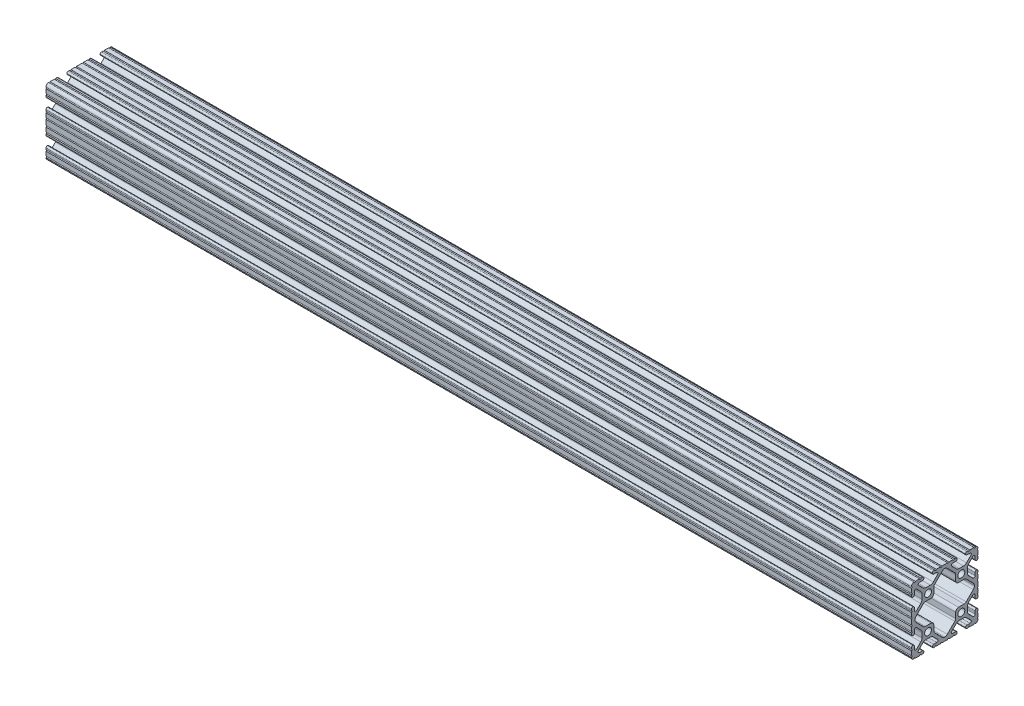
SolidWorks part; units mm, degrees
ref_plane "Front Plane" through (0, 0, 0) normal (0, 0, 1) x (1, 0, 0)
ref_plane "Top Plane" through (0, 0, 0) normal (0, 1, 0) x (1, 0, 0)
ref_plane "Right Plane" through (0, 0, 0) normal (1, 0, 0) x (0, 0, -1)
sketch "Sketch1" plane through (0, 0, 0) normal (1, 0, 0) x (0, 0, -1)
  line L0 (-7.684, -16.0797) -> (-1.9878, -21.7759)
  line L1 (-8.3312, -10.3886) -> (-8.3312, -14.5171)
  line L2 (-14.8165, -8.1788) -> (-10.541, -8.1788)
  line L3 (-21.7734, -2.1502) -> (-16.3772, -7.5334)
  line L4 (-22.6314, 0.0822) -> (-22.6314, -0.0822)
  line L5 (-16.3772, 7.5334) -> (-21.7734, 2.1502)
  line L6 (-10.541, 8.1788) -> (-14.8165, 8.1788)
  line L7 (-8.3312, 14.5171) -> (-8.3312, 10.3886)
  line L8 (-1.7956, 21.9681) -> (-7.684, 16.0797)
  line L9 (7.684, 16.0797) -> (1.7956, 21.9681)
  line L10 (8.3312, 10.389) -> (8.3312, 14.5171)
  line L11 (14.8161, 8.1792) -> (10.541, 8.1792)
  line L12 (21.7734, 2.1502) -> (16.3768, 7.5339)
  line L13 (22.6314, -0.0822) -> (22.6314, 0.0822)
  line L14 (16.3772, -7.5334) -> (21.7734, -2.1502)
  line L15 (10.541, -8.1788) -> (14.8165, -8.1788)
  line L16 (8.3312, -14.5171) -> (8.3312, -10.3886)
  line L17 (1.9878, -21.7759) -> (7.684, -16.0797)
  line L18 (7.4579, -25.3998) -> (8.4051, -25.3998)
  line L19 (9.4615, -24.3585) -> (9.4615, -24.2315)
  line L20 (8.4051, -23.1902) -> (6.0878, -23.1902)
  line L21 (5.388, -21.5008) -> (8.763, -18.1257)
  line L22 (11.0081, -17.1958) -> (14.3919, -17.1958)
  line L23 (16.637, -18.1257) -> (20.012, -21.5008)
  line L24 (19.2977, -23.1901) -> (16.9799, -23.1901)
  line L25 (15.9385, -24.2315) -> (15.9385, -24.3585)
  line L26 (16.9949, -25.3998) -> (18.134, -25.3998)
  line L27 (19.1384, -25.3998) -> (22.4132, -25.3998)
  line L28 (23.4176, -25.3998) -> (23.4501, -25.3998)
  line L29 (25.4, -23.2975) -> (25.4, -23.2686)
  line L30 (25.4, -22.2526) -> (25.4, -19.0252)
  line L31 (25.4, -18.0092) -> (25.4, -16.916)
  line L32 (24.3586, -15.8746) -> (24.2316, -15.8746)
  line L33 (23.1902, -16.916) -> (23.1902, -19.101)
  line L34 (21.4558, -19.8194) -> (18.2781, -16.6418)
  line L35 (17.3482, -14.3967) -> (17.3482, -11.0035)
  line L36 (18.2808, -8.7557) -> (21.4566, -5.5875)
  line L37 (23.1902, -6.3068) -> (23.1902, -8.484)
  line L38 (24.2316, -9.5254) -> (24.3586, -9.5254)
  line L39 (25.4, -8.484) -> (25.4, -7.3277)
  line L40 (25.4, -6.3117) -> (25.4, -3.0843)
  line L41 (25.4, -2.0683) -> (25.4, 2.0683)
  line L42 (25.4, 3.0843) -> (25.4, 6.3117)
  line L43 (25.4, 7.3277) -> (25.4, 8.484)
  line L44 (24.3586, 9.5254) -> (24.2316, 9.5254)
  line L45 (23.1902, 8.484) -> (23.1902, 6.3068)
  line L46 (21.4566, 5.5875) -> (18.2808, 8.7557)
  line L47 (17.3482, 11.0035) -> (17.3482, 14.3967)
  line L48 (18.2781, 16.6418) -> (21.4558, 19.8194)
  line L49 (23.1902, 19.101) -> (23.1902, 16.916)
  line L50 (24.2316, 15.8746) -> (24.3586, 15.8746)
  line L51 (25.4, 16.916) -> (25.4, 18.0092)
  line L52 (25.4, 19.0252) -> (25.4, 22.2526)
  line L53 (25.4, 23.2686) -> (25.4, 23.2975)
  line L54 (23.4501, 25.3998) -> (23.4176, 25.3998)
  line L55 (22.4132, 25.3998) -> (19.1384, 25.3998)
  line L56 (18.134, 25.3998) -> (16.9949, 25.3998)
  line L57 (15.9385, 24.3585) -> (15.9385, 24.2315)
  line L58 (16.9799, 23.1901) -> (19.2977, 23.1901)
  line L59 (20.012, 21.5008) -> (16.637, 18.1257)
  line L60 (14.3919, 17.1958) -> (11.0081, 17.1958)
  line L61 (8.763, 18.1257) -> (5.388, 21.5008)
  line L62 (6.0878, 23.1902) -> (8.4051, 23.1902)
  line L63 (9.4615, 24.2315) -> (9.4615, 24.3585)
  line L64 (8.4051, 25.3998) -> (7.4579, 25.3998)
  line L65 (6.4535, 25.3998) -> (3.2145, 25.3998)
  line L66 (2.2101, 25.3998) -> (-2.2101, 25.3998)
  line L67 (-3.2145, 25.3998) -> (-6.4535, 25.3998)
  line L68 (-7.4579, 25.3998) -> (-8.4051, 25.3998)
  line L69 (-9.4615, 24.3585) -> (-9.4615, 24.2315)
  line L70 (-8.4051, 23.1902) -> (-6.0878, 23.1902)
  line L71 (-5.388, 21.5008) -> (-8.763, 18.1257)
  line L72 (-11.0081, 17.1958) -> (-14.3919, 17.1958)
  line L73 (-16.637, 18.1257) -> (-20.012, 21.5008)
  line L74 (-19.2977, 23.1901) -> (-16.9799, 23.1901)
  line L75 (-15.9385, 24.2315) -> (-15.9385, 24.3585)
  line L76 (-16.9949, 25.3998) -> (-18.134, 25.3998)
  line L77 (-19.1384, 25.3998) -> (-22.4132, 25.3998)
  line L78 (-23.4176, 25.3998) -> (-23.4501, 25.3998)
  line L79 (-25.4, 23.2975) -> (-25.4, 23.2686)
  line L80 (-25.4, 22.2526) -> (-25.4, 19.0252)
  line L81 (-25.4, 18.0092) -> (-25.4, 16.916)
  line L82 (-24.3586, 15.8746) -> (-24.2316, 15.8746)
  line L83 (-23.1902, 16.916) -> (-23.1902, 19.101)
  line L84 (-21.4558, 19.8194) -> (-18.2781, 16.6418)
  line L85 (-17.3482, 14.3967) -> (-17.3482, 11.0035)
  line L86 (-18.2808, 8.7557) -> (-21.4566, 5.5875)
  line L87 (-23.1902, 6.3068) -> (-23.1902, 8.484)
  line L88 (-24.2316, 9.5254) -> (-24.3586, 9.5254)
  line L89 (-25.4, 8.484) -> (-25.4, 7.3277)
  line L90 (-25.4, 6.3117) -> (-25.4, 3.0843)
  line L91 (-25.4, 2.0683) -> (-25.4, -2.0683)
  line L92 (-25.4, -3.0843) -> (-25.4, -6.3117)
  line L93 (-25.4, -7.3277) -> (-25.4, -8.484)
  line L94 (-24.3586, -9.5254) -> (-24.2316, -9.5254)
  line L95 (-23.1902, -8.484) -> (-23.1902, -6.3068)
  line L96 (-21.4566, -5.5875) -> (-18.2808, -8.7557)
  line L97 (-17.3482, -11.0035) -> (-17.3482, -14.3967)
  line L98 (-18.2781, -16.6418) -> (-21.4558, -19.8194)
  line L99 (-23.1902, -19.101) -> (-23.1902, -16.916)
  line L100 (-24.2316, -15.8746) -> (-24.3586, -15.8746)
  line L101 (-25.4, -16.916) -> (-25.4, -18.0092)
  line L102 (-25.4, -19.0252) -> (-25.4, -22.2526)
  line L103 (-25.4, -23.2686) -> (-25.4, -23.2975)
  line L104 (-23.4501, -25.3998) -> (-23.4176, -25.3998)
  line L105 (-22.4132, -25.3998) -> (-19.1384, -25.3998)
  line L106 (-18.134, -25.3998) -> (-16.9949, -25.3998)
  line L107 (-15.9385, -24.3585) -> (-15.9385, -24.2315)
  line L108 (-16.9799, -23.1901) -> (-19.2977, -23.1901)
  line L109 (-20.012, -21.5008) -> (-16.637, -18.1257)
  line L110 (-14.3919, -17.1958) -> (-11.0081, -17.1958)
  line L111 (-8.763, -18.1257) -> (-5.388, -21.5008)
  line L112 (-6.0878, -23.1902) -> (-8.4051, -23.1902)
  line L113 (-9.4615, -24.2315) -> (-9.4615, -24.3585)
  line L114 (-8.4051, -25.3998) -> (-7.4579, -25.3998)
  line L115 (-6.4535, -25.3998) -> (-3.2145, -25.3998)
  line L116 (-2.2101, -25.3998) -> (2.2101, -25.3998)
  line L117 (3.2145, -25.3998) -> (6.4535, -25.3998)
  circle A0 centre (12.7, 12.7) radius 2.6035
  circle A1 centre (-12.7, 12.7) radius 2.6035
  circle A2 centre (-12.7, -12.7) radius 2.6035
  arc A3 (0, -22.6304) -> (1.9878, -21.7759) centre (-0.0777, -19.7104) ccw
  arc A4 (-1.9878, -21.7759) -> (0, -22.6304) centre (0.0777, -19.7104) ccw
  arc A5 (-8.3312, -14.5171) -> (-7.684, -16.0797) centre (-6.1214, -14.5171) ccw
  arc A6 (-8.3312, -10.3886) -> (-10.541, -8.1788) centre (-10.541, -10.3886) ccw
  arc A7 (-16.3772, -7.5334) -> (-14.8165, -8.1788) centre (-14.8165, -5.969) ccw
  arc A8 (-22.6314, -0.0822) -> (-21.7734, -2.1502) centre (-19.7104, -0.0822) ccw
  arc A9 (-21.7734, 2.1502) -> (-22.6314, 0.0822) centre (-19.7104, 0.0822) ccw
  arc A10 (-14.8165, 8.1788) -> (-16.3772, 7.5334) centre (-14.8165, 5.969) ccw
  arc A11 (-10.541, 8.1788) -> (-8.3312, 10.3886) centre (-10.541, 10.3886) ccw
  arc A12 (-7.684, 16.0797) -> (-8.3312, 14.5171) centre (-6.1214, 14.5171) ccw
  arc A13 (0, 22.8111) -> (-1.7956, 21.9681) centre (0.2699, 19.9026) ccw
  arc A14 (1.7956, 21.9681) -> (0, 22.8111) centre (-0.2699, 19.9026) ccw
  arc A15 (8.3312, 14.5171) -> (7.684, 16.0797) centre (6.1214, 14.5171) ccw
  arc A16 (8.3312, 10.389) -> (10.541, 8.1792) centre (10.541, 10.389) ccw
  arc A17 (16.3768, 7.5339) -> (14.8161, 8.1792) centre (14.8161, 5.9694) ccw
  arc A18 (22.6314, 0.0822) -> (21.7734, 2.1502) centre (19.7104, 0.0822) ccw
  arc A19 (21.7734, -2.1502) -> (22.6314, -0.0822) centre (19.7104, -0.0822) ccw
  arc A20 (14.8165, -8.1788) -> (16.3772, -7.5334) centre (14.8165, -5.969) ccw
  arc A21 (10.541, -8.1788) -> (8.3312, -10.3886) centre (10.541, -10.3886) ccw
  arc A22 (7.684, -16.0797) -> (8.3312, -14.5171) centre (6.1214, -14.5171) ccw
  circle A23 centre (12.7, -12.7) radius 2.6035
  arc A24 (7.4579, -25.3998) -> (6.4535, -25.3998) centre (6.9557, -25.3232) ccw
  arc A25 (8.4051, -25.3998) -> (9.4615, -24.3585) centre (8.4201, -24.3585) ccw
  arc A26 (9.4615, -24.2315) -> (8.4051, -23.1902) centre (8.4201, -24.2315) ccw
  arc A27 (5.388, -21.5008) -> (6.0878, -23.1902) centre (6.0878, -22.2006) ccw
  arc A28 (11.0081, -17.1958) -> (8.763, -18.1257) centre (11.0081, -20.3708) ccw
  arc A29 (16.637, -18.1257) -> (14.3919, -17.1958) centre (14.3919, -20.3708) ccw
  arc A30 (19.2977, -23.1901) -> (20.012, -21.5008) centre (19.3122, -22.2006) ccw
  arc A31 (16.9799, -23.1901) -> (15.9385, -24.2315) centre (16.9799, -24.2315) ccw
  arc A32 (15.9385, -24.3585) -> (16.9949, -25.3998) centre (16.9799, -24.3585) ccw
  arc A33 (19.1384, -25.3998) -> (18.134, -25.3998) centre (18.6362, -25.3232) ccw
  arc A34 (23.4176, -25.3998) -> (22.4132, -25.3998) centre (22.9154, -25.3232) ccw
  arc A35 (23.4501, -25.3998) -> (25.4, -23.2975) centre (23.2918, -23.2975) ccw
  arc A36 (25.4, -22.2526) -> (25.4, -23.2686) centre (25.4, -22.7606) ccw
  arc A37 (25.4, -18.0092) -> (25.4, -19.0252) centre (25.4, -18.5172) ccw
  arc A38 (25.4, -16.916) -> (24.3586, -15.8746) centre (24.3586, -16.916) ccw
  arc A39 (24.2316, -15.8746) -> (23.1902, -16.916) centre (24.2316, -16.916) ccw
  arc A40 (21.4558, -19.8194) -> (23.1902, -19.101) centre (22.1742, -19.101) ccw
  arc A41 (17.3482, -14.3967) -> (18.2781, -16.6418) centre (20.5232, -14.3967) ccw
  arc A42 (18.2808, -8.7557) -> (17.3482, -11.0035) centre (20.5232, -11.0035) ccw
  arc A43 (23.1902, -6.3068) -> (21.4566, -5.5875) centre (22.1742, -6.3068) ccw
  arc A44 (23.1902, -8.484) -> (24.2316, -9.5254) centre (24.2316, -8.484) ccw
  arc A45 (24.3586, -9.5254) -> (25.4, -8.484) centre (24.3586, -8.484) ccw
  arc A46 (25.4, -6.3117) -> (25.4, -7.3277) centre (25.4, -6.8197) ccw
  arc A47 (25.4, -2.0683) -> (25.4, -3.0843) centre (25.4, -2.5763) ccw
  arc A48 (25.4, 3.0843) -> (25.4, 2.0683) centre (25.4, 2.5763) ccw
  arc A49 (25.4, 7.3277) -> (25.4, 6.3117) centre (25.4, 6.8197) ccw
  arc A50 (25.4, 8.484) -> (24.3586, 9.5254) centre (24.3586, 8.484) ccw
  arc A51 (24.2316, 9.5254) -> (23.1902, 8.484) centre (24.2316, 8.484) ccw
  arc A52 (21.4566, 5.5875) -> (23.1902, 6.3068) centre (22.1742, 6.3068) ccw
  arc A53 (17.3482, 11.0035) -> (18.2808, 8.7557) centre (20.5232, 11.0035) ccw
  arc A54 (18.2781, 16.6418) -> (17.3482, 14.3967) centre (20.5232, 14.3967) ccw
  arc A55 (23.1902, 19.101) -> (21.4558, 19.8194) centre (22.1742, 19.101) ccw
  arc A56 (23.1902, 16.916) -> (24.2316, 15.8746) centre (24.2316, 16.916) ccw
  arc A57 (24.3586, 15.8746) -> (25.4, 16.916) centre (24.3586, 16.916) ccw
  arc A58 (25.4, 19.0252) -> (25.4, 18.0092) centre (25.4, 18.5172) ccw
  arc A59 (25.4, 23.2686) -> (25.4, 22.2526) centre (25.4, 22.7606) ccw
  arc A60 (25.4, 23.2975) -> (23.4501, 25.3998) centre (23.2918, 23.2975) ccw
  arc A61 (22.4132, 25.3998) -> (23.4176, 25.3998) centre (22.9154, 25.3232) ccw
  arc A62 (18.134, 25.3998) -> (19.1384, 25.3998) centre (18.6362, 25.3232) ccw
  arc A63 (16.9949, 25.3998) -> (15.9385, 24.3585) centre (16.9799, 24.3585) ccw
  arc A64 (15.9385, 24.2315) -> (16.9799, 23.1901) centre (16.9799, 24.2315) ccw
  arc A65 (20.012, 21.5008) -> (19.2977, 23.1901) centre (19.3122, 22.2006) ccw
  arc A66 (14.3919, 17.1958) -> (16.637, 18.1257) centre (14.3919, 20.3708) ccw
  arc A67 (8.763, 18.1257) -> (11.0081, 17.1958) centre (11.0081, 20.3708) ccw
  arc A68 (6.0878, 23.1902) -> (5.388, 21.5008) centre (6.0878, 22.2006) ccw
  arc A69 (8.4051, 23.1902) -> (9.4615, 24.2315) centre (8.4201, 24.2315) ccw
  arc A70 (9.4615, 24.3585) -> (8.4051, 25.3998) centre (8.4201, 24.3585) ccw
  arc A71 (6.4535, 25.3998) -> (7.4579, 25.3998) centre (6.9557, 25.3232) ccw
  arc A72 (2.2101, 25.3998) -> (3.2145, 25.3998) centre (2.7123, 25.3232) ccw
  arc A73 (-3.2145, 25.3998) -> (-2.2101, 25.3998) centre (-2.7123, 25.3232) ccw
  arc A74 (-7.4579, 25.3998) -> (-6.4535, 25.3998) centre (-6.9557, 25.3232) ccw
  arc A75 (-8.4051, 25.3998) -> (-9.4615, 24.3585) centre (-8.4201, 24.3585) ccw
  arc A76 (-9.4615, 24.2315) -> (-8.4051, 23.1902) centre (-8.4201, 24.2315) ccw
  arc A77 (-5.388, 21.5008) -> (-6.0878, 23.1902) centre (-6.0878, 22.2006) ccw
  arc A78 (-11.0081, 17.1958) -> (-8.763, 18.1257) centre (-11.0081, 20.3708) ccw
  arc A79 (-16.637, 18.1257) -> (-14.3919, 17.1958) centre (-14.3919, 20.3708) ccw
  arc A80 (-19.2977, 23.1901) -> (-20.012, 21.5008) centre (-19.3122, 22.2006) ccw
  arc A81 (-16.9799, 23.1901) -> (-15.9385, 24.2315) centre (-16.9799, 24.2315) ccw
  arc A82 (-15.9385, 24.3585) -> (-16.9949, 25.3998) centre (-16.9799, 24.3585) ccw
  arc A83 (-19.1384, 25.3998) -> (-18.134, 25.3998) centre (-18.6362, 25.3232) ccw
  arc A84 (-23.4176, 25.3998) -> (-22.4132, 25.3998) centre (-22.9154, 25.3232) ccw
  arc A85 (-23.4501, 25.3998) -> (-25.4, 23.2975) centre (-23.2918, 23.2975) ccw
  arc A86 (-25.4, 22.2526) -> (-25.4, 23.2686) centre (-25.4, 22.7606) ccw
  arc A87 (-25.4, 18.0092) -> (-25.4, 19.0252) centre (-25.4, 18.5172) ccw
  arc A88 (-25.4, 16.916) -> (-24.3586, 15.8746) centre (-24.3586, 16.916) ccw
  arc A89 (-24.2316, 15.8746) -> (-23.1902, 16.916) centre (-24.2316, 16.916) ccw
  arc A90 (-21.4558, 19.8194) -> (-23.1902, 19.101) centre (-22.1742, 19.101) ccw
  arc A91 (-17.3482, 14.3967) -> (-18.2781, 16.6418) centre (-20.5232, 14.3967) ccw
  arc A92 (-18.2808, 8.7557) -> (-17.3482, 11.0035) centre (-20.5232, 11.0035) ccw
  arc A93 (-23.1902, 6.3068) -> (-21.4566, 5.5875) centre (-22.1742, 6.3068) ccw
  arc A94 (-23.1902, 8.484) -> (-24.2316, 9.5254) centre (-24.2316, 8.484) ccw
  arc A95 (-24.3586, 9.5254) -> (-25.4, 8.484) centre (-24.3586, 8.484) ccw
  arc A96 (-25.4, 6.3117) -> (-25.4, 7.3277) centre (-25.4, 6.8197) ccw
  arc A97 (-25.4, 2.0683) -> (-25.4, 3.0843) centre (-25.4, 2.5763) ccw
  arc A98 (-25.4, -3.0843) -> (-25.4, -2.0683) centre (-25.4, -2.5763) ccw
  arc A99 (-25.4, -7.3277) -> (-25.4, -6.3117) centre (-25.4, -6.8197) ccw
  arc A100 (-25.4, -8.484) -> (-24.3586, -9.5254) centre (-24.3586, -8.484) ccw
  arc A101 (-24.2316, -9.5254) -> (-23.1902, -8.484) centre (-24.2316, -8.484) ccw
  arc A102 (-21.4566, -5.5875) -> (-23.1902, -6.3068) centre (-22.1742, -6.3068) ccw
  arc A103 (-17.3482, -11.0035) -> (-18.2808, -8.7557) centre (-20.5232, -11.0035) ccw
  arc A104 (-18.2781, -16.6418) -> (-17.3482, -14.3967) centre (-20.5232, -14.3967) ccw
  arc A105 (-23.1902, -19.101) -> (-21.4558, -19.8194) centre (-22.1742, -19.101) ccw
  arc A106 (-23.1902, -16.916) -> (-24.2316, -15.8746) centre (-24.2316, -16.916) ccw
  arc A107 (-24.3586, -15.8746) -> (-25.4, -16.916) centre (-24.3586, -16.916) ccw
  arc A108 (-25.4, -19.0252) -> (-25.4, -18.0092) centre (-25.4, -18.5172) ccw
  arc A109 (-25.4, -23.2686) -> (-25.4, -22.2526) centre (-25.4, -22.7606) ccw
  arc A110 (-25.4, -23.2975) -> (-23.4501, -25.3998) centre (-23.2918, -23.2975) ccw
  arc A111 (-22.4132, -25.3998) -> (-23.4176, -25.3998) centre (-22.9154, -25.3232) ccw
  arc A112 (-18.134, -25.3998) -> (-19.1384, -25.3998) centre (-18.6362, -25.3232) ccw
  arc A113 (-16.9949, -25.3998) -> (-15.9385, -24.3585) centre (-16.9799, -24.3585) ccw
  arc A114 (-15.9385, -24.2315) -> (-16.9799, -23.1901) centre (-16.9799, -24.2315) ccw
  arc A115 (-20.012, -21.5008) -> (-19.2977, -23.1901) centre (-19.3122, -22.2006) ccw
  arc A116 (-14.3919, -17.1958) -> (-16.637, -18.1257) centre (-14.3919, -20.3708) ccw
  arc A117 (-8.763, -18.1257) -> (-11.0081, -17.1958) centre (-11.0081, -20.3708) ccw
  arc A118 (-6.0878, -23.1902) -> (-5.388, -21.5008) centre (-6.0878, -22.2006) ccw
  arc A119 (-8.4051, -23.1902) -> (-9.4615, -24.2315) centre (-8.4201, -24.2315) ccw
  arc A120 (-9.4615, -24.3585) -> (-8.4051, -25.3998) centre (-8.4201, -24.3585) ccw
  arc A121 (-6.4535, -25.3998) -> (-7.4579, -25.3998) centre (-6.9557, -25.3232) ccw
  arc A122 (-2.2101, -25.3998) -> (-3.2145, -25.3998) centre (-2.7123, -25.3232) ccw
  arc A123 (3.2145, -25.3998) -> (2.2101, -25.3998) centre (2.7123, -25.3232) ccw
extrude "Extrude1" add sketch "Sketch1" against normal mid plane 660.4
